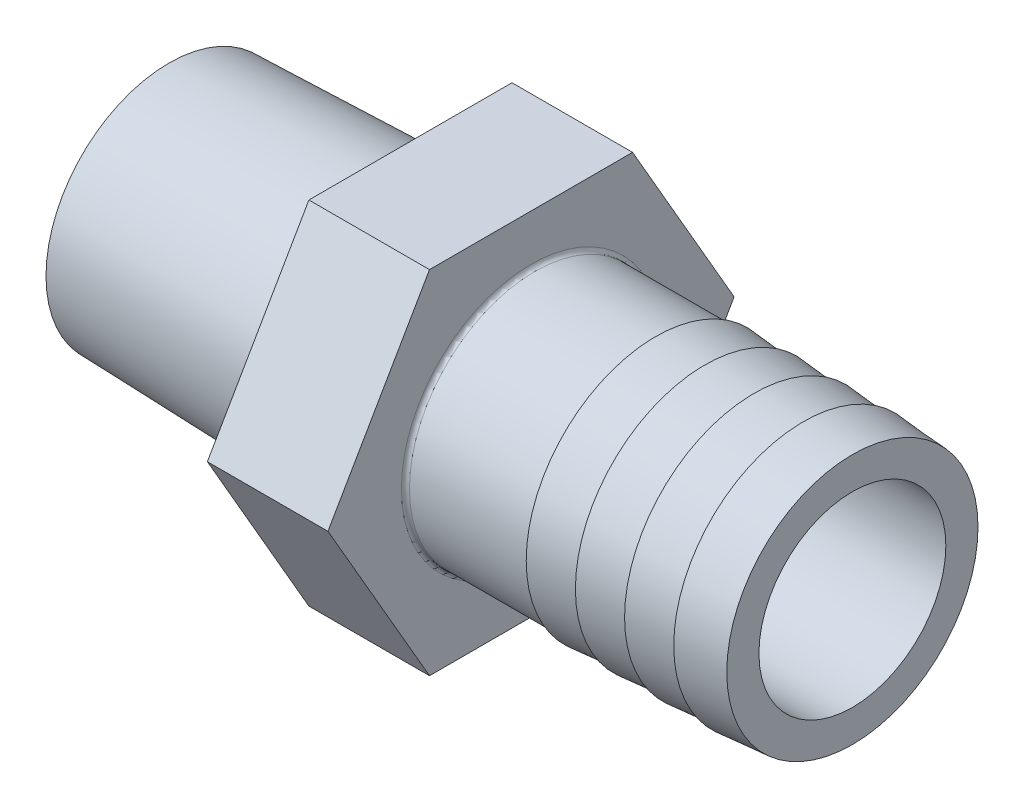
SolidWorks part; units mm, degrees
ref_plane "Plane1" through (0, 0, 0) normal (0, 0, 1) x (1, 0, 0)
ref_plane "Plane2" through (0, 0, 0) normal (0, 1, 0) x (1, 0, 0)
ref_plane "Plane3" through (0, 0, 0) normal (1, 0, 0) x (0, 0, -1)
sketch "Sketch1" plane through (0, 0, 0) normal (0, 0, 1) x (1, 0, 0)
  line L0 (-15.2552, 7.7725) -> (0, 8.2493)
  line L1 (-15.2552, 7.7725) -> (-15.2552, 5.9055)
  line L2 (0, 8.2493) -> (7.62, 8.2493)
  line L3 (7.62, 8.2493) -> (7.62, 8.1915)
  line L4 (7.874, 7.9375) -> (15.494, 7.9375)
  line L5 (15.494, 7.9375) -> (15.494, 8.1788)
  line L6 (15.494, 8.1788) -> (18.6017, 7.9375)
  line L7 (18.6017, 7.9375) -> (18.6017, 8.1788)
  line L8 (18.6017, 8.1788) -> (21.7094, 7.9375)
  line L9 (-50.8, 0) -> (127, 0) construction
  line L10 (21.7094, 7.9375) -> (21.7094, 8.1788)
  line L11 (-15.2552, 5.9055) -> (27.9248, 5.9055)
  line L12 (27.9248, 5.9055) -> (27.9248, 7.9375)
  line L13 (21.7094, 8.1788) -> (24.8171, 7.9375)
  line L14 (24.8171, 7.9375) -> (24.8171, 8.1788)
  line L15 (24.8171, 8.1788) -> (27.9248, 7.9375)
  arc A0 (7.874, 7.9375) -> (7.62, 8.1915) centre (7.874, 8.1915) cw
  dimension "D5" = 0.254
  dimension "D1" = 5.9055
  dimension "D3" = 7.7725
  dimension "D4" = 15.2552
  dimension "D6" = 1.79
  dimension "D7" = 7.9375
  dimension "D8" = 7.62
  dimension "D9" = 7.62
  dimension "D10" = 8.1788
  dimension "D11" = 20.3048
revolve "Base-Revolve" add sketch "Sketch1" angle 360 about L9
sketch "Sketch2" plane through (7.62, 0, 0) normal (1, 0, 0) x (0, 0, -1)
  line L1 (12.8316, 0) -> (6.4158, 11.1125)
  line L2 (6.4158, 11.1125) -> (-6.4158, 11.1125)
  line L3 (-6.4158, 11.1125) -> (-12.8316, 0)
  line L4 (-12.8316, 0) -> (-6.4158, -11.1125)
  line L5 (-6.4158, -11.1125) -> (6.4158, -11.1125)
  line L6 (6.4158, -11.1125) -> (12.8316, 0)
  circle A0 centre (0, 0) radius 11.1125 construction
extrude "nut" add sketch "Sketch2" along normal up to surface (7.62 mm away)
sketch "Sketch3" [suppressed] plane through (0, 0, 0) normal (0, 0, 1) x (1, 0, 0)
  line L0 (0, 0) -> (0, 11.1125) construction
  line L1 (-9.525, 11.6215) -> (-19.6914, 11.6215)
  line L2 (-9.525, 11.6215) -> (-9.525, -12.3017)
  line L3 (-9.525, -12.3017) -> (-19.6914, -12.3017)
  line L4 (-19.6914, 11.6215) -> (-19.6914, -12.3017)
  dimension "D1" = 9.525
extrude "Cut-Extrude1" [suppressed] cut sketch "Sketch3" against normal through all and the other way through all
